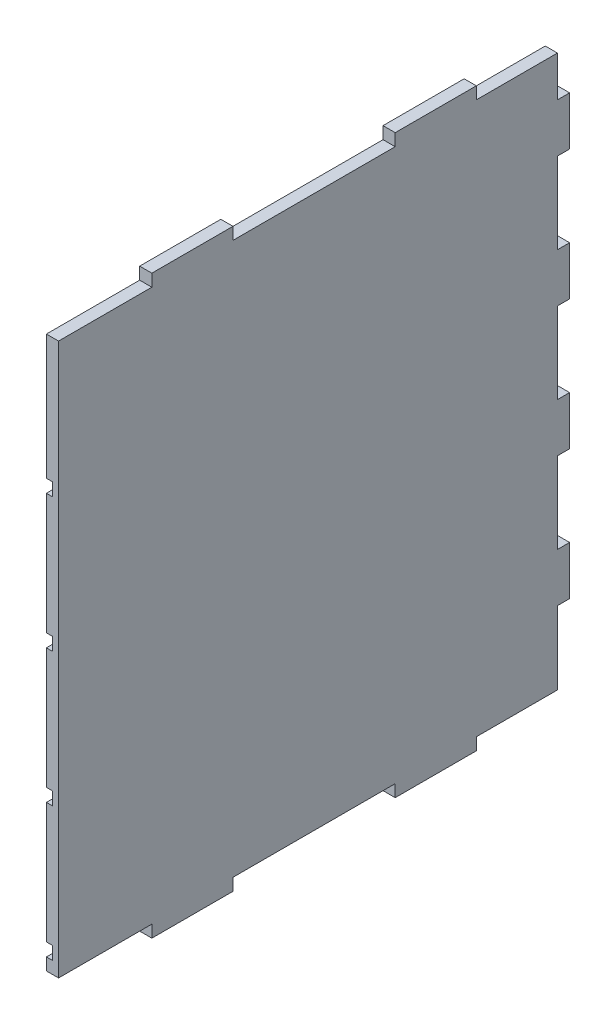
SolidWorks part; units mm, degrees
ref_plane "Alzado" through (0, 0, 0) normal (0, 0, 1) x (1, 0, 0)
ref_plane "Planta" through (0, 0, 0) normal (0, 1, 0) x (1, 0, 0)
ref_plane "Vista lateral" through (0, 0, 0) normal (1, 0, 0) x (0, 0, -1)
sketch "Croquis1" plane through (0, 0, 0) normal (0, 0, 1) x (1, 0, 0)
  line L0 (-7.5, 710) -> (-7.5, 0) construction
  line L1 (0, 0) -> (-15, 0)
  line L2 (0, 0) -> (0, 710)
  line L3 (0, 710) -> (-15, 710)
  line L4 (-15, 0) -> (-15, 30)
  line L5 (-15, 30) -> (-7.5, 30)
  line L6 (-7.5, 30) -> (-7.5, 46)
  line L7 (-7.5, 46) -> (-15, 46)
  line L8 (-7.5, 211) -> (-15, 211)
  line L9 (-7.5, 195) -> (-7.5, 211)
  line L10 (-15, 195) -> (-7.5, 195)
  line L11 (-7.5, 376) -> (-15, 376)
  line L12 (-7.5, 360) -> (-7.5, 376)
  line L13 (-15, 360) -> (-7.5, 360)
  line L14 (-7.5, 541) -> (-15, 541)
  line L15 (-7.5, 525) -> (-7.5, 541)
  line L16 (-15, 525) -> (-7.5, 525)
  line L17 (-15, 46) -> (-15, 195)
  line L18 (-15, 211) -> (-15, 360)
  line L19 (-15, 376) -> (-15, 525)
  line L20 (-15, 541) -> (-15, 710)
extrude "Saliente-Extruir1" add sketch "Croquis1" along normal blind 630
sketch "Croquis2" plane through (0, 0, 0) normal (1, 0, 0) x (0, 0, -1)
  line L0 (0, 0) -> (0, 710) construction
  line L1 (0, 15) -> (-115, 15)
  line L2 (-115, 15) -> (-115, 0)
  line L3 (-630, 0) -> (0, 0) construction
  line L4 (-115, 0) -> (0, 0)
  line L5 (0, 0) -> (0, 15)
  line L6 (-215, 0) -> (-215, 15)
  line L7 (-215, 15) -> (-415, 15)
  line L8 (-415, 15) -> (-415, 0)
  line L9 (-415, 0) -> (-215, 0)
  line L10 (-630, 0) -> (-630, 15)
  line L11 (-630, 0) -> (-630, 710) construction
  line L12 (-630, 15) -> (-515, 15)
  line L13 (-515, 15) -> (-515, 0)
  line L14 (-515, 0) -> (-630, 0)
  line L15 (-515, 15) -> (-415, 15) construction
  line L16 (-215, 15) -> (-115, 15) construction
  line L17 (0, 355) -> (-630, 355) construction
  line L18 (-215, 695) -> (-115, 695) construction
  line L19 (-515, 695) -> (-415, 695) construction
  line L20 (-515, 710) -> (-630, 710)
  line L21 (-515, 695) -> (-515, 710)
  line L22 (-630, 695) -> (-515, 695)
  line L23 (-630, 710) -> (-630, 695)
  line L24 (-415, 710) -> (-215, 710)
  line L25 (-415, 695) -> (-415, 710)
  line L26 (-215, 695) -> (-415, 695)
  line L27 (-215, 710) -> (-215, 695)
  line L28 (0, 710) -> (0, 695)
  line L29 (-115, 710) -> (0, 710)
  line L30 (-115, 695) -> (-115, 710)
  line L31 (0, 695) -> (-115, 695)
  point P18 (-165, 15)
  point P21 (-465, 15)
extrude "Cortar-Extruir1" cut sketch "Croquis2" against normal through all
sketch "Croquis3" plane through (-15, 0, 0) normal (-1, 0, 0) x (0, 0, 1)
  line L0 (0, 105) -> (0, 165) construction
  line L1 (0, 105) -> (15, 105)
  line L2 (0, 105) -> (0, 5)
  line L3 (0, 5) -> (15, 5)
  line L4 (15, 105) -> (15, 5)
  line L5 (0, 525) -> (0, 376) construction
  line L6 (0, 265) -> (15, 265)
  line L7 (0, 265) -> (0, 165)
  line L8 (0, 165) -> (15, 165)
  line L9 (15, 265) -> (15, 165)
  line L10 (0, 695) -> (0, 541) construction
  line L11 (0, 425) -> (15, 425)
  line L12 (0, 425) -> (0, 325)
  line L13 (0, 325) -> (15, 325)
  line L14 (15, 425) -> (15, 325)
  line L15 (0, 645) -> (0, 585) construction
  line L16 (0, 265) -> (0, 325) construction
  line L17 (0, 485) -> (0, 425) construction
  line L18 (0, 585) -> (15, 585)
  line L19 (0, 585) -> (0, 485)
  line L20 (0, 485) -> (15, 485)
  line L21 (15, 585) -> (15, 485)
  line L23 (0, 645) -> (15, 645)
  line L24 (0, 645) -> (0, 745)
  line L25 (0, 745) -> (15, 745)
  line L26 (15, 645) -> (15, 745)
  line L27 (315, 695) -> (315, 15) construction
  line L28 (415, 695) -> (215, 695) construction
  line L29 (215, 15) -> (415, 15) construction
  point P21 (0, 695)
extrude "Cortar-Extruir3" cut sketch "Croquis3" against normal through all
equation "\"D1@Croquis1\"= \"thicknes\""
equation "\"thicknes\"=15"
equation "\"profbase\"= 400"
equation "\"anchbase\"= 400"
equation "\"altura\"=150"
equation "\"clearens\"=0"
equation "\"joind1\"=100"
equation "\"D3@Croquis1\"=\"thicknes\"+1"
equation "\"profmueble\"= \"profbase\" + 200 + 2 * \"thicknes\""
equation "\"D1@Saliente-Extruir1\"=\"profmueble\""
equation "\"Malto\"= 710"
equation "\"D2@Croquis1\" = \"Malto\""
equation "\"D1@Croquis2\"=\"joind1\""
equation "\"D2@Croquis2\"=\"joind1\""
equation "\"D4@Croquis2\"=\"thicknes\""
equation "\"D1@Croquis3\"=\"thicknes\""
equation "\"D2@Croquis3\"=\"joind1\"+\"clearens\""
